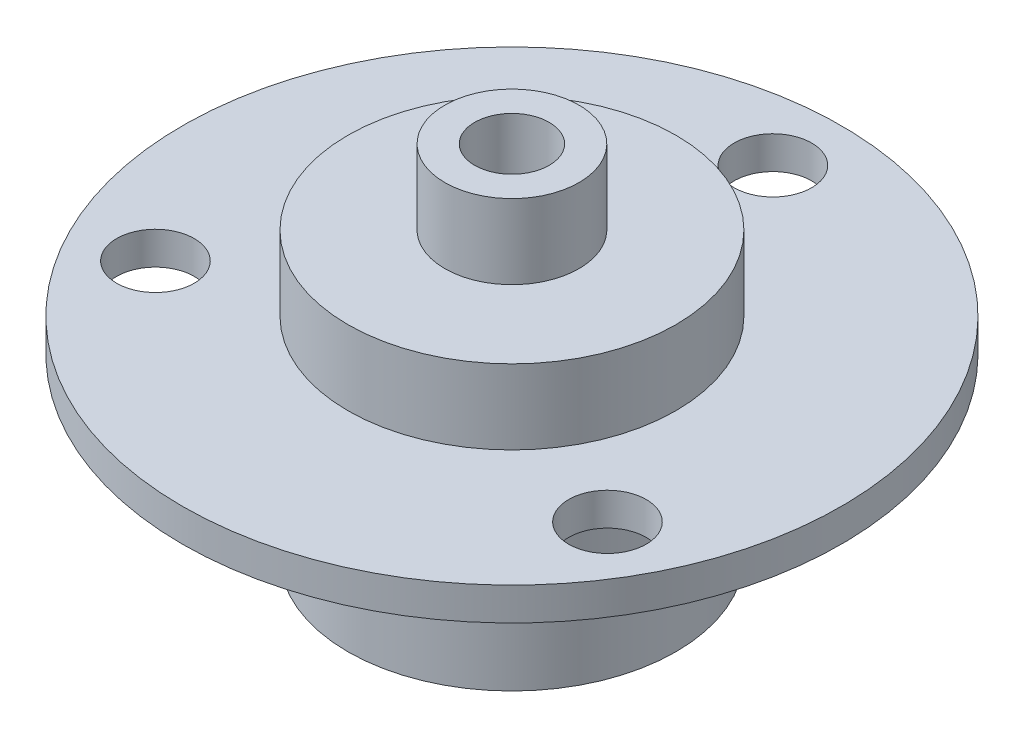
SolidWorks part; units mm, degrees
ref_plane "前视基准面" through (0, 0, 0) normal (0, 0, 1) x (1, 0, 0)
ref_plane "上视基准面" through (0, 0, 0) normal (0, 1, 0) x (1, 0, 0)
ref_plane "右视基准面" through (0, 0, 0) normal (1, 0, 0) x (0, 0, -1)
sketch "草图2" plane through (0, 0, 0) normal (0, 1, 0) x (1, 0, 0)
  circle A0 centre (0, 0) radius 22.1
  dimension "D1" = 44.2
extrude "凸台-拉伸1" add sketch "草图2" along normal blind 2.2
sketch "草图3" plane through (0, 2.2, 0) normal (0, 1, 0) x (1, 0, 0)
  line L0 (0, 0) -> (0, 22.1) construction
  circle A0 centre (0, 0) radius 22.1 construction
  circle A1 centre (0, 17.5) radius 2.6
  circle A2 centre (15.1554, -8.75) radius 2.6
  circle A3 centre (-15.1554, -8.75) radius 2.6
  circle A4 centre (0, 0) radius 17.5 construction
  point P10 (0, 0)
  point P14 (0, 0)
  point P15 (0, 0)
  dimension "D1" = 5.2
  dimension "D2" = 17.5
  dimension "D3" = 3
extrude "切除-拉伸1" cut sketch "草图3" against normal through all both and the other way through all
sketch "草图4" plane through (0, 2.2, 0) normal (0, 1, 0) x (1, 0, 0)
  circle A0 centre (0, 0) radius 11
  dimension "D1" = 22
extrude "凸台-拉伸2" add sketch "草图4" along normal blind 5
sketch "草图5" plane through (0, 0, 0) normal (0, -1, 0) x (1, 0, 0)
  circle A0 centre (0, 0) radius 11
  dimension "D1" = 22
extrude "凸台-拉伸3" add sketch "草图5" along normal blind 11.8
sketch "草图7" plane through (0, 7.2, 0) normal (0, 1, 0) x (1, 0, 0)
  circle A0 centre (0, 0) radius 4.5
  dimension "D1" = 9
extrude "凸台-拉伸4" add sketch "草图7" along normal blind 5
sketch "草图8" plane through (0, 12.2, 0) normal (0, 1, 0) x (1, 0, 0)
  circle A0 centre (0, 0) radius 2.5
  dimension "D1" = 5
extrude "切除-拉伸2" cut sketch "草图8" against normal through all both and the other way through all
